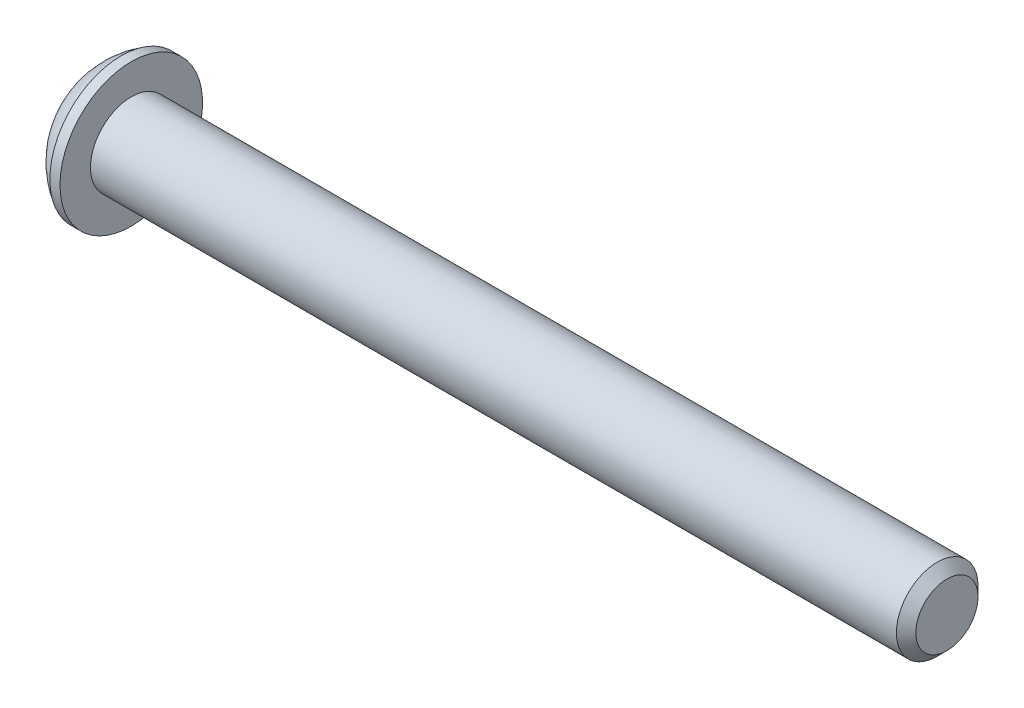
SolidWorks part; units mm, degrees
ref_plane "Plane1" through (0, 0, 0) normal (0, 0, 1) x (1, 0, 0)
ref_plane "Plane2" through (0, 0, 0) normal (0, 1, 0) x (1, 0, 0)
ref_plane "Plane3" through (0, 0, 0) normal (1, 0, 0) x (0, 0, -1)
sketch "BodySke" plane through (0, 0, 0) normal (0, 0, 1) x (1, 0, 0)
  line L0 (66.8528, 0) -> (66.8528, 2.4193)
  line L1 (66.0971, 3.175) -> (3.3528, 3.175)
  line L2 (3.3528, 3.175) -> (3.3528, 5.5499)
  line L3 (3.3528, 5.5499) -> (2.5654, 5.5499)
  line L4 (0, 0) -> (101.6, 0) construction
  line L5 (3.3528, -5.5499) -> (2.5654, -5.5499) construction
  line L6 (55.6768, -3.175) -> (3.3528, -3.175) construction
  line L7 (66.8528, 0) -> (0, 0)
  line L8 (0, 2.775) -> (0, -2.775) construction
  line L9 (0, 0) -> (0, 2.775)
  line L10 (66.8528, 2.4193) -> (66.0971, 3.175)
  line L11 (66.8528, -2.4193) -> (66.0971, -3.175) construction
  line L12 (4.6228, 9.525) -> (4.6228, -3.175) construction
  line L13 (3.3528, 9.525) -> (3.3528, -3.175) construction
  arc A1 (0, 2.775) -> (2.5654, 5.5499) centre (5.7851, 0) cw
  dimension "D1" = 5.5499
  dimension "Diameter" = 6.35
  dimension "Length" = 63.5
  dimension "Head_dia" = 11.0998
  dimension "Head_ht" = 3.3528
  dimension "Head_side_ht" = 0.7874
  dimension "Minor_dia" = 4.8387
  dimension "Body_ch_ang" = 45
  dimension "Advance" = 1.27
  dimension "Thread_nom" = 63.5
revolve "BaseBody" add sketch "BodySke" angle 360 about L4
sketch "Sketch2" plane through (0, 0, 0) normal (0, 0, 1) x (1, 0, 0)
  line L0 (0, 1.9812) -> (2.2098, 1.9812)
  line L1 (2.2098, 1.9812) -> (3.3536, 0)
  line L3 (3.3536, 0) -> (0, 0)
  line L4 (0, 0) -> (0, 1.9812)
  line L5 (0, -1.9812) -> (2.2098, -1.9812) construction
  line L6 (0, 0) -> (47.625, 0) construction
  dimension "D2" = 60
  dimension "PreBroach_depth" = 2.2098
  dimension "PreBroach_dia" = 3.9624
revolve "PreBroach" cut sketch "Sketch2" angle 360 about L6
sketch "Sketch3" plane through (0, 0, 0) normal (1, 0, 0) x (0, 0, -1)
  line L0 (-1.9812, -1.1438) -> (-1.9812, 1.1438)
  line L1 (-1.9812, 1.1438) -> (0, 2.2877)
  line L2 (0, 2.2877) -> (1.9812, 1.1438)
  line L3 (1.9812, 1.1438) -> (1.9812, -1.1438)
  line L4 (1.9812, -1.1438) -> (0, -2.2877)
  line L5 (0, -2.2877) -> (-1.9812, -1.1438)
  dimension "D1" = 1.9812
  dimension "D2" = 1.9812
  dimension "D3" = 3.9624
  dimension "Hex_size" = 3.9624
extrude "Hex" cut sketch "Sketch3" along normal blind 2.2098
sketch "Sketch4" plane through (0, 9.525, 0) normal (1, 0, 0) x (0, 0, -1)
  line L0 (0, -9.525) -> (2.3876, -9.525)
  line L1 (0, -9.525) -> (6.1484, -5.9752) construction
  line L2 (0, -9.525) -> (1.1938, -7.4573)
  line L3 (1.9883, -8.949) -> (2.2704, -8.7861)
  line L4 (1.493, -8.0911) -> (1.7751, -7.9282)
  arc A0 (1.9883, -8.949) -> (1.493, -8.0911) centre (0, -9.525) ccw
  arc A1 (2.3876, -9.525) -> (2.2704, -8.7861) centre (0, -9.525) ccw
  arc A2 (1.1938, -7.4573) -> (1.7751, -7.9282) centre (0, -9.525) cw
  dimension "D1" = 30
  dimension "Spline_n_dim" = 4.1402
  dimension "Spline_m_dim" = 4.7752
  dimension "D2" = 60
  dimension "D3" = 0.4953
  dimension "Spline_p_dim" = 0.9906
extrude "Spline" [suppressed] cut sketch "Sketch4" along normal blind 2.2098
pattern_circular "CirPattern1" [suppressed] count 6 every 60 about axis through (0, 0, 0) along (1, 0, 0)
sketch "ThdSchSke" plane through (0, 0, 0) normal (0, 0, 1) x (1, 0, 0)
  line L0 (4.6228, -2.4193) -> (4.0937, -3.175)
  line L1 (4.6228, -2.4193) -> (5.1519, -3.175)
  line L2 (5.1519, -3.175) -> (5.1519, -3.9688)
  line L3 (-3.175, 0) -> (5.1513, 0) construction
  line L5 (5.1519, -3.9688) -> (4.0937, -3.9688)
  line L6 (4.0937, -3.9688) -> (4.0937, -3.175)
  dimension "Thread_minor" = 4.8387
  dimension "Diameter" = 6.35
  dimension "Start" = 4.6228
  dimension "SideAngle" = 55
  dimension "VeeAngle" = 70
  dimension "Overcut" = 7.9375
revolve "ThreadSchematic" [suppressed] cut sketch "ThdSchSke" angle 360 about L3
pattern_linear "ThdSchPat" [suppressed]
equation "\"D1@BodySke\" = \"Head_dia@BodySke\" * .5"
equation "\"Thread_minor@ThreadCosmetic\" = \"Minor_dia@BodySke\""
equation "\"D1@Sketch3\" = \"Hex_size@Sketch3\" / 2"
equation "\"D2@Sketch3\" = \"D1@Sketch3\""
equation "\"D3@Sketch3\" = \"Hex_size@Sketch3\""
equation "\"D3@Sketch4\" = \"Spline_p_dim@Sketch4\" / 2"
equation "\"D1@Sketch4\" = \"D2@Sketch4\" / 2"
equation "\"Thread_length@ThreadCosmetic\" = ((sgn( (\"Length@BodySke\" - \"Advance@BodySke\" ) - \"Thread_nom@BodySke\" )-1)*( (\"Length@BodySke\" - \"Advance@BodySke\" ) - \"Thread_nom@BodySke\" ))/-2+ \"Thread_nom@BodySke\""
equation "\"Thread_minor@ThdSchSke\" = \"Minor_dia@BodySke\""
equation "\"Diameter@ThdSchSke\" = \"Diameter@BodySke\""
equation "\"Overcut@ThdSchSke\" = \"Diameter@BodySke\" * 1.25"
equation "\"Start@ThdSchSke\" = \"Head_ht@BodySke\" + \"Length@BodySke\" - \"Thread_length@ThreadCosmetic\"  '---Non-countersunk---"
equation "\"Num_threads@ThdSchPat\" = int( \"Thread_length@ThreadCosmetic\" / \"Advance@BodySke\" + 0.999 )  + 1"
equation "\"Advance@ThdSchPat\" = \"Thread_length@ThreadCosmetic\" /  (\"Num_threads@ThdSchPat\" - 1) 'relax it"
equation "\"Num_threads@ThdSchPat\" = \"Num_threads@ThdSchPat\" - sgn( \"Num_threads@ThdSchPat\" - 1) '---chamfered tips only---"
